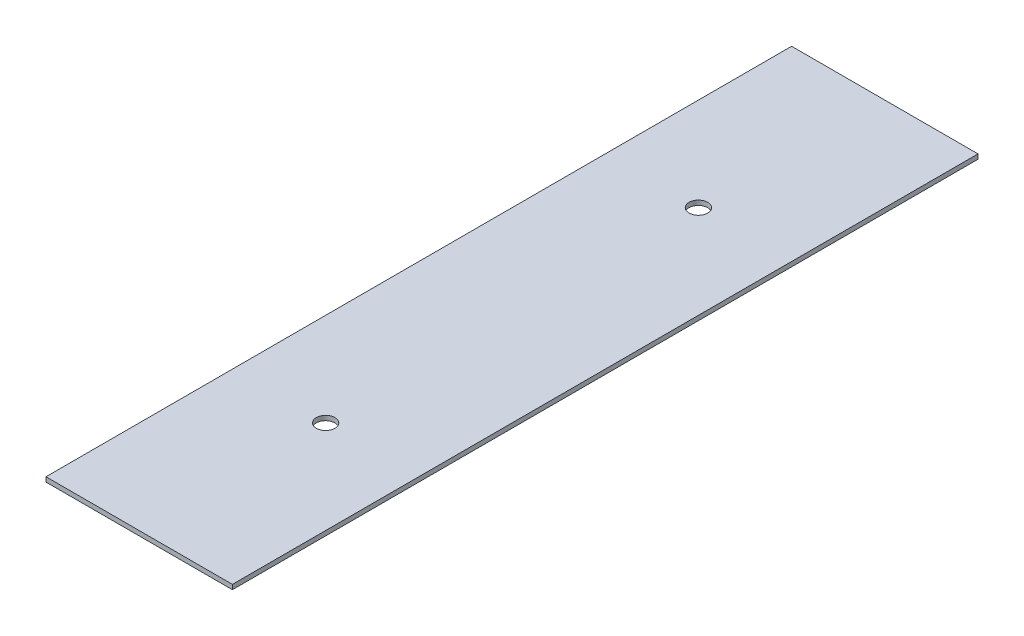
SolidWorks part; units mm, degrees
ref_plane "Front Plane" through (0, 0, 0) normal (0, 0, 1) x (1, 0, 0)
ref_plane "Top Plane" through (0, 0, 0) normal (0, 1, 0) x (1, 0, 0)
ref_plane "Right Plane" through (0, 0, 0) normal (1, 0, 0) x (0, 0, -1)
sketch "Sketch2" plane through (0, -1136.65, 0) normal (0, -1, 0) x (1, 0, 0)
  line L1 (-1016, 508) -> (-1016, -508)
  line L4 (2387.6, 0) -> (3403.6, 0) construction
  point P4 (-1016, 0)
sketch "Sketch3" plane through (0, 0, 0) normal (0, 0, 1) x (1, 0, 0)
  line L0 (-1016, -1136.65) -> (-1016, -1143) construction
  line L1 (-1270, -1143) -> (-1016, -1143) construction
  line L2 (-1270, -1136.65) -> (-1270, -1143) construction
  line L3 (-1016, -1136.65) -> (-1016, -1143)
  line L4 (-1270, -1143) -> (-1016, -1143)
  line L5 (-1270, -1136.65) -> (-1270, -1143)
  line L6 (-1270, -1136.65) -> (-1016, -1136.65)
extrude "Extrude1" add sketch "Sketch3" along normal up to vertex (508 mm away) and the other way up to vertex (508 mm away)
sketch "Sketch5" plane through (0, -1136.65, 0) normal (0, 1, 0) x (1, 0, 0)
  line L0 (-1143, 508) -> (-1143, -508) construction
  line L1 (-1016, 508) -> (-1270, 508) construction
  line L2 (-1016, -508) -> (-1270, -508) construction
  line L3 (-1143, 0) -> (-1270, 0) construction
  line L4 (-1270, -508) -> (-1270, 508) construction
  circle A0 centre (-1143, -254) radius 12.7
  circle A1 centre (-1143, 254) radius 12.7
extrude "Cut-Extrude1" cut sketch "Sketch5" against normal through all
equation "\"D3@Sketch5\" = \"D1@Sketch5\"/4"
